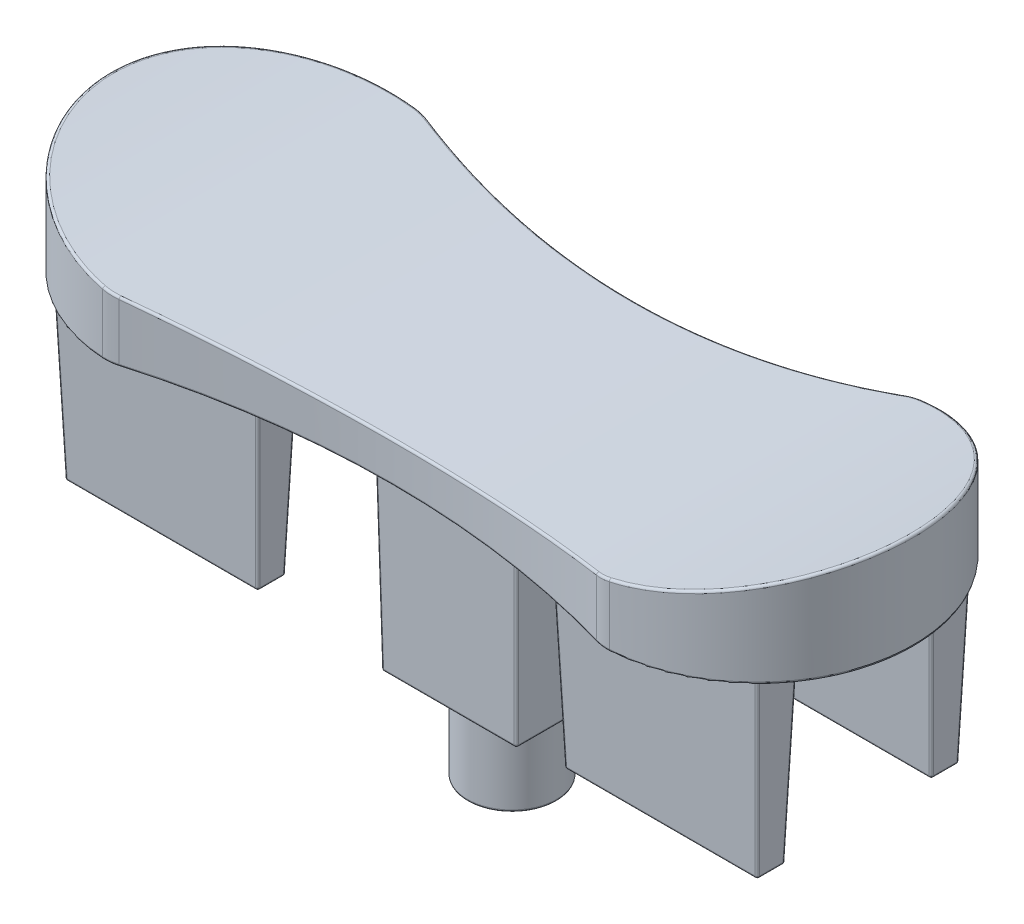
SolidWorks part; units mm, degrees
ref_plane "Front Plane" through (0, 0, 0) normal (0, 0, 1) x (1, 0, 0)
ref_plane "Top Plane" through (0, 0, 0) normal (0, 1, 0) x (1, 0, 0)
ref_plane "Right Plane" through (0, 0, 0) normal (1, 0, 0) x (0, 0, -1)
sketch "Sketch5" plane through (0, 0, 0) normal (0, 1, 0) x (1, 0, 0)
  line L1 (1.6, 1.5) -> (-1.6, 1.5)
  line L2 (1.6, 1.5) -> (1.6, -1.5)
  line L3 (1.6, -1.5) -> (-1.6, -1.5)
  line L4 (-1.6, 1.5) -> (-1.6, -1.5)
  line L5 (1.6, 1.5) -> (-1.6, -1.5) construction
  line L6 (1.6, -1.5) -> (-1.6, 1.5) construction
  point P0 (0, 0)
  dimension "D1" = 3
  dimension "D2" = 3.2
extrude "MAIN BODY" add sketch "Sketch5" against normal blind 5 draft 1
sketch "Sketch11" plane through (0, 0, 0) normal (0, -1, 0) x (-1, 0, 0)
  line L0 (5.5, 0) -> (-5.5, 0) construction
  line L1 (5.5, -3.5) -> (-5.5, -3.5)
  line L2 (5.5, 3.5) -> (-5.5, 3.5)
  line L4 (-5.5, 0) -> (-9, 0) construction
  line L5 (5.5, 0) -> (9, 0) construction
  arc A0 (5.5, -3.5) -> (5.5, 3.5) centre (5.5, 0) ccw
  arc A1 (-5.5, 3.5) -> (-5.5, -3.5) centre (-5.5, 0) ccw
  point P2 (0, 0)
  dimension "D2" = 3.5
  dimension "D1" = 11
  dimension "D3" = 18
extrude "TOP BUTTON" add sketch "Sketch11" against normal blind 2.2
sketch "Sketch12" plane through (0, 0, 3.5) normal (0, 0, 1) x (1, 0, 0)
  line L0 (0, 0) -> (0, 32.7038) construction
  line L2 (-5.5, 0) -> (5.5, 0) construction
  line L3 (0, 0) -> (0, 0.9) construction
  circle A0 centre (0, 32.7038) radius 31.8038
  point P3 (-9, 2.2)
  dimension "D1" = 0.9
extrude "Cut-Extrude6" cut sketch "Sketch12" against normal up to next
sketch "Sketch13" plane through (0, 0, 0) normal (0, -1, 0) x (-1, 0, 0)
  line L0 (0, 22.0062) -> (0, 3.5) construction
  line L1 (5.5, 3.5) -> (-5.5, 3.5) construction
  line L2 (-2, 0) -> (2, 0) construction
  line L3 (0, 0) -> (0, 2.7) construction
  circle A0 centre (0, 22.0062) radius 19.3062
  arc A2 (5.5, -3.5) -> (5.5, 3.5) centre (5.5, 0) ccw construction
  arc A3 (-5.5, 3.5) -> (-5.5, -3.5) centre (-5.5, 0) ccw construction
  point P8 (0, 0)
  dimension "D1" = 2.7
extrude "Cut-Extrude7" cut sketch "Sketch13" against normal through all
mirror "Mirror1" about plane through (0, 0, 0) normal (0, 0, 1) of "Cut-Extrude7"
sketch "Sketch14" plane through (0, -5, 0) normal (0, -1, 0) x (1, 0, 0)
  circle A0 centre (0, 0) radius 1
  dimension "D1" = 2
extrude "Boss-Extrude1" add sketch "Sketch14" along normal blind 2
sketch "Sketch15" plane through (0, 0, 0) normal (0, -1, 0) x (-1, 0, 0)
  line L1 (-3.3, 1.5) -> (-7.9, 1.5)
  line L2 (-3.3, 1.5) -> (-3.3, 2.4)
  line L3 (-3.3, 2.4) -> (-7.9, 2.4)
  line L4 (-7.9, 1.5) -> (-7.9, 2.4)
  line L5 (-3.3, 1.5) -> (-7.9, 2.4) construction
  line L6 (-3.3, 2.4) -> (-7.9, 1.5) construction
  point P0 (-5.6, 1.95)
  dimension "D1" = 4.6
  dimension "D2" = 0.9
  dimension "D3" = 1.5
  dimension "D4" = 3.3
extrude "Boss-Extrude2" add sketch "Sketch15" along normal blind 4 draft 2
mirror "Mirror2" about plane through (0, 0, 0) normal (0, 0, 1) of "Boss-Extrude2"
mirror "Mirror3" about plane through (0, 0, 0) normal (1, 0, 0) of "Mirror2", "Boss-Extrude2"
fillet "Fillet1" radius 1 4 edges at (-5.5, 0.6896, 3.5) (5.5, 0.6896, 3.5) (5.5, 0.6896, -3.5) (-5.5, 0.6896, -3.5)
fillet "Fillet4" radius 0.05 70 edges at (-3.3, 0, 1.95) (-5.6, 0, 2.4) (-7.9, 0, 1.95) (-5.6, 0, 1.5) (3.3, 0, -1.95) (5.6, 0, -2.4) (7.9, 0, -1.95) (5.6, 0, -1.5) (1.6, 0, 0) (0, 0, 1.5) (-1.6, 0, 0) (0, 0, -1.5) (5.5177, 0, 3.49) (9, 0, 0) (5.5177, 0, -3.49) (0, 0, -2.7) (-5.5177, 0, -3.49) (-9, 0, 0) (-5.5177, 0, 3.49) (0, 0, 2.7) (5.6, 0, 2.4) (3.3, 0, 1.95) (5.6, 0, 1.5) (7.9, 0, 1.95) (-5.6, 0, -2.4) (-3.3, 0, -1.95) (-5.6, 0, -1.5) (-7.9, 0, -1.95) (0, -7, -1) (0, -5, 1.4127) (0, -5, -1) (-1.5564, -2.5, 1.4564) (-1.5127, -5, 0) (-1.5564, -2.5, -1.4564) (0, -5, -1.4127) (1.5564, -2.5, -1.4564) (1.5127, -5, 0) (1.5564, -2.5, 1.4564) (7.7603, -4, 1.95) (7.7603, -4, -1.95) (3.4397, -4, -1.95) (3.4397, -4, 1.95) (3.3698, -2, 1.5698) (5.6, -4, 1.6397) (7.8302, -2, 1.5698) (3.3698, -2, -2.3302) (5.6, -4, -2.2603) (7.8302, -2, -2.3302) (7.8302, -2, -1.5698) (5.6, -4, -1.6397) (3.3698, -2, -1.5698) (7.8302, -2, 2.3302) (5.6, -4, 2.2603) (3.3698, -2, 2.3302) (-3.3698, -2, 2.3302) (-7.8302, -2, 2.3302) (-5.6, -4, 2.2603) (-3.4397, -4, 1.95) (-7.7603, -4, 1.95) (-7.8302, -2, 1.5698) (-5.6, -4, 1.6397) (-3.3698, -2, 1.5698) (-5.6, -4, -1.6397) (-7.8302, -2, -1.5698) (-7.7603, -4, -1.95) (-3.4397, -4, -1.95) (-3.3698, -2, -1.5698) (-7.8302, -2, -2.3302) (-5.6, -4, -2.2603) (-3.3698, -2, -2.3302)
fillet "Fillet5" radius 0.05 8 edges at (-0.0806, 0.9001, -2.7002) (8.9685, 2.1907, 0.4687) (-0.0806, 0.9001, 2.7002) (-8.9685, 2.1907, -0.4687)
